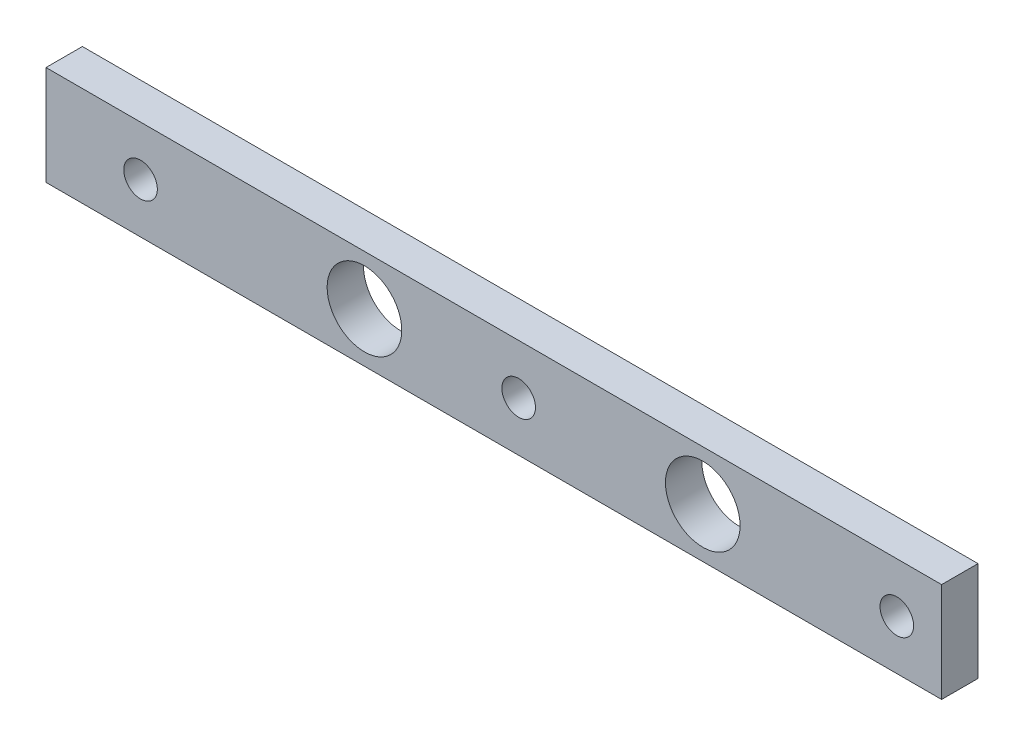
SolidWorks part; units mm, degrees
ref_plane "Front" through (0, 0, 0) normal (0, 0, 1) x (1, 0, 0)
ref_plane "Top" through (0, 0, 0) normal (0, 1, 0) x (1, 0, 0)
ref_plane "Right" through (0, 0, 0) normal (1, 0, 0) x (0, 0, -1)
sketch "Sketch1" plane through (0, 0, 0) normal (0, 0, 1) x (1, 0, 0)
  line L0 (-578.612, 0) -> (-618.363, 0) construction
  line L2 (-741.045, 57.15) -> (-455.295, 57.15)
  line L3 (-741.045, 57.15) -> (-741.045, 25.4)
  line L4 (-741.045, 25.4) -> (-455.295, 25.4)
  line L5 (-455.295, 57.15) -> (-455.295, 25.4)
  line L6 (-452.12, -180.975) -> (-452.12, 149.225) construction
  line L7 (-744.22, 149.225) -> (-744.22, -180.975) construction
  dimension "D1" = 31.75
  dimension "D2" = 3.175
  dimension "D3" = 3.175
  dimension "D4" = 25.4
extrude "Boss-Extrude1" add sketch "Sketch1" along normal blind 11.6082 separate body
hole_wizard "Hole1" positions "Point_Sketch" profile "Profil_Sketch" counterbore size "1/4" standard "ANSI Inch"
sketch "Point_Sketch" plane through (-721.2394, 42.21, 11.6082) normal (0, 0, -1) x (1, 0, 0)
  point P0 (10.3569, 0.935)
  point P2 (251.6569, 0.935)
  point P4 (131.0069, 0.935)
sketch "Profil_Sketch" plane through (-710.8825, 41.275, 11.6082) normal (1, 0, 0) x (0, -1, 0)
  line L0 (0, 0) -> (0, 11.6082)
  line L1 (0, 11.6082) -> (3.5687, 11.6082)
  line L3 (3.5687, 11.6082) -> (3.5687, 7.874)
  line L4 (3.5687, 7.874) -> (5.3594, 7.874)
  line L5 (5.3594, 7.874) -> (5.3594, 0)
  line L7 (5.3594, 0) -> (0, 0)
  line L11 (0, -6.35) -> (0, 107.95) construction
  dimension "Diameter" = 7.1374
  dimension "Thru Hole Depth" = 11.6082
  dimension "L1" = 7.874
other "usin_LS160_.25-20x.625-SHCS<1>"
hole_wizard "Hole11" positions "Point_Sketch1" profile "Profil_Sketch1" hole size "Ø0.15" standard "ISO"
sketch "Point_Sketch1" plane through (-477.0407, 102.6761, 0) normal (0, 0, 1) x (-1, 0, 0)
  point P0 (162.4043, 61.4011)
  point P2 (54.4543, 61.4011)
sketch "Profil_Sketch1" plane through (-639.445, 41.275, 0) normal (1, 0, 0) x (0, 1, 0)
  line L0 (0, 0) -> (0, 11.6082)
  line L1 (0, 11.6082) -> (11.9062, 11.6082)
  line L2 (11.9062, 11.6082) -> (11.9062, 0)
  line L5 (11.9062, 0) -> (0, 0)
  line L11 (0, -6.35) -> (0, 107.95) construction
  dimension "Diameter" = 23.8125
  dimension "Thru Hole Depth" = 11.6082
other "usin_DL090_DADCO INCH U 0600.025 - 1500 psi<1>"
